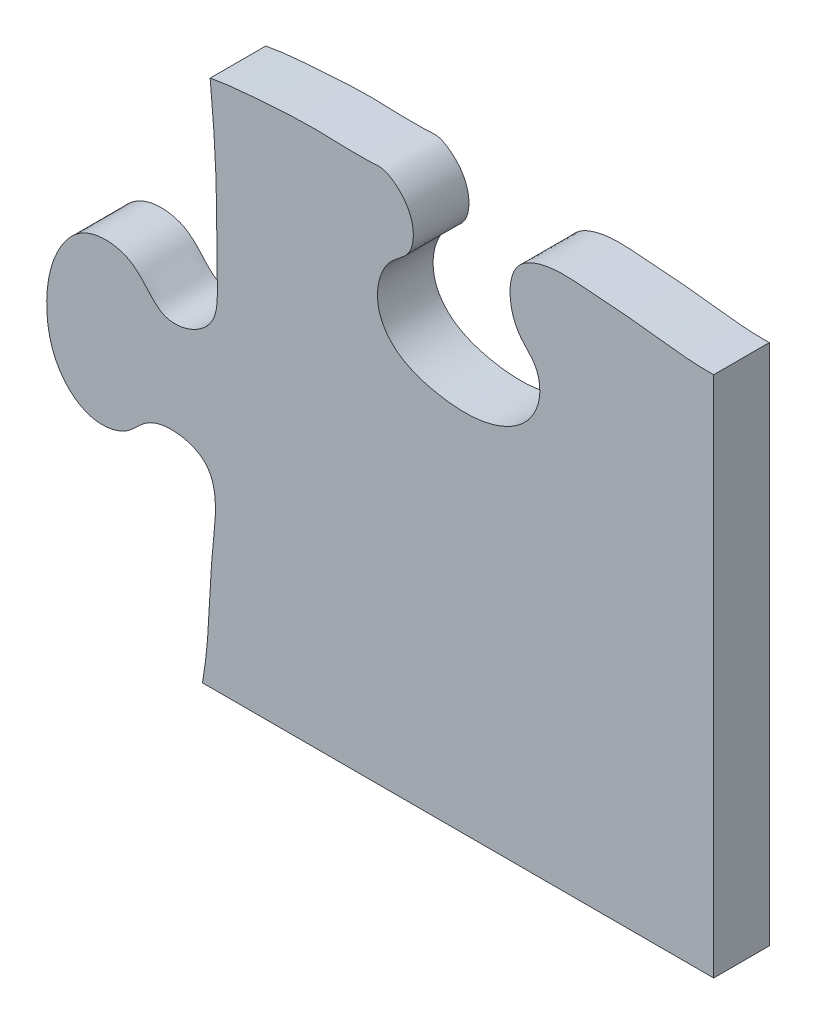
SolidWorks part; units mm, degrees
ref_plane "Front Plane" through (0, 0, 0) normal (0, 0, 1) x (1, 0, 0)
ref_plane "Top Plane" through (0, 0, 0) normal (0, 1, 0) x (1, 0, 0)
ref_plane "Right Plane" through (0, 0, 0) normal (1, 0, 0) x (0, 0, -1)
body saved out of another part "Stock-pluzze-1"
